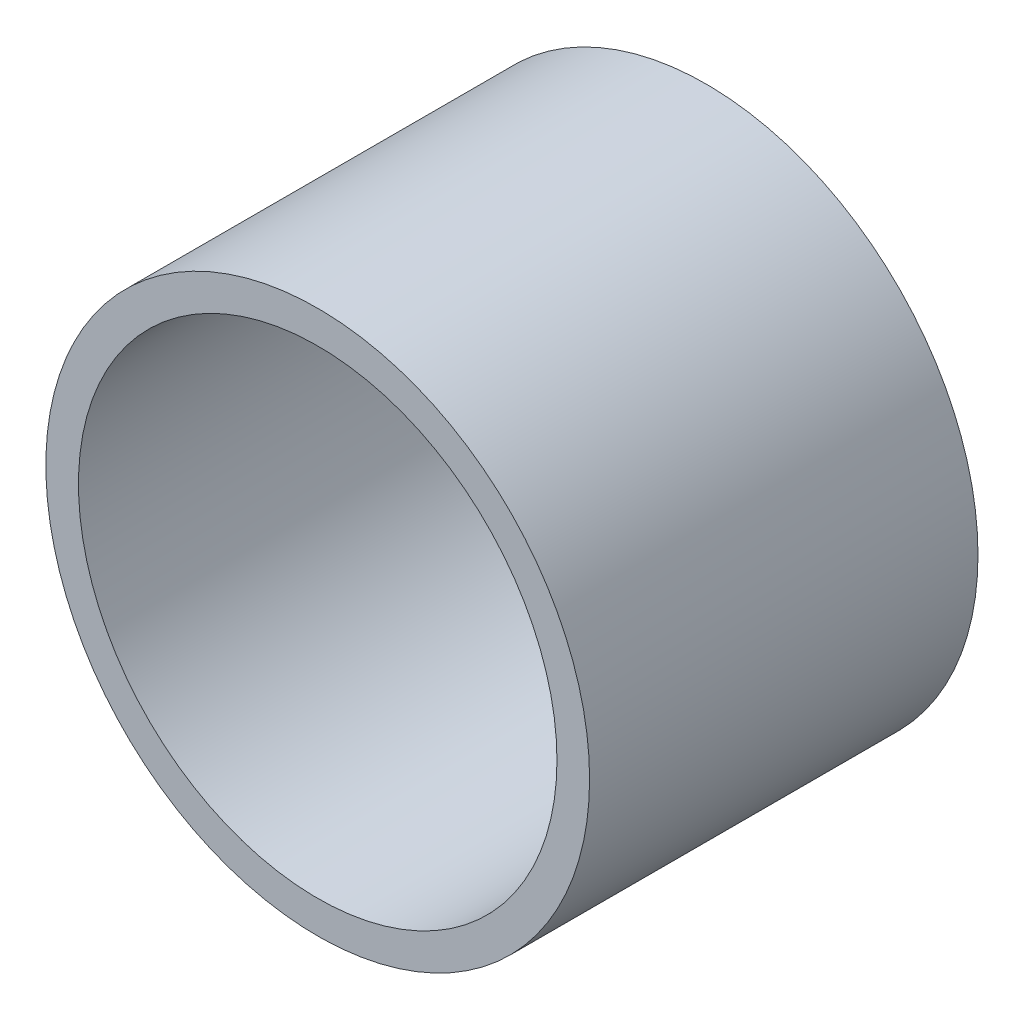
SolidWorks part; units mm, degrees
ref_plane "Front Plane" through (0, 0, 0) normal (0, 0, 1) x (1, 0, 0)
ref_plane "Top Plane" through (0, 0, 0) normal (0, 1, 0) x (1, 0, 0)
ref_plane "Right Plane" through (0, 0, 0) normal (1, 0, 0) x (0, 0, -1)
sketch "Sketch1" plane through (0, 0, 0) normal (0, 0, 1) x (1, 0, 0)
  circle A0 centre (0, 0) radius 3.9116
  circle A1 centre (0, 0) radius 4.445
  dimension "D1" = 7.8232
  dimension "D2" = 8.89
extrude "Boss-Extrude1" add sketch "Sketch1" along normal blind 6.35
